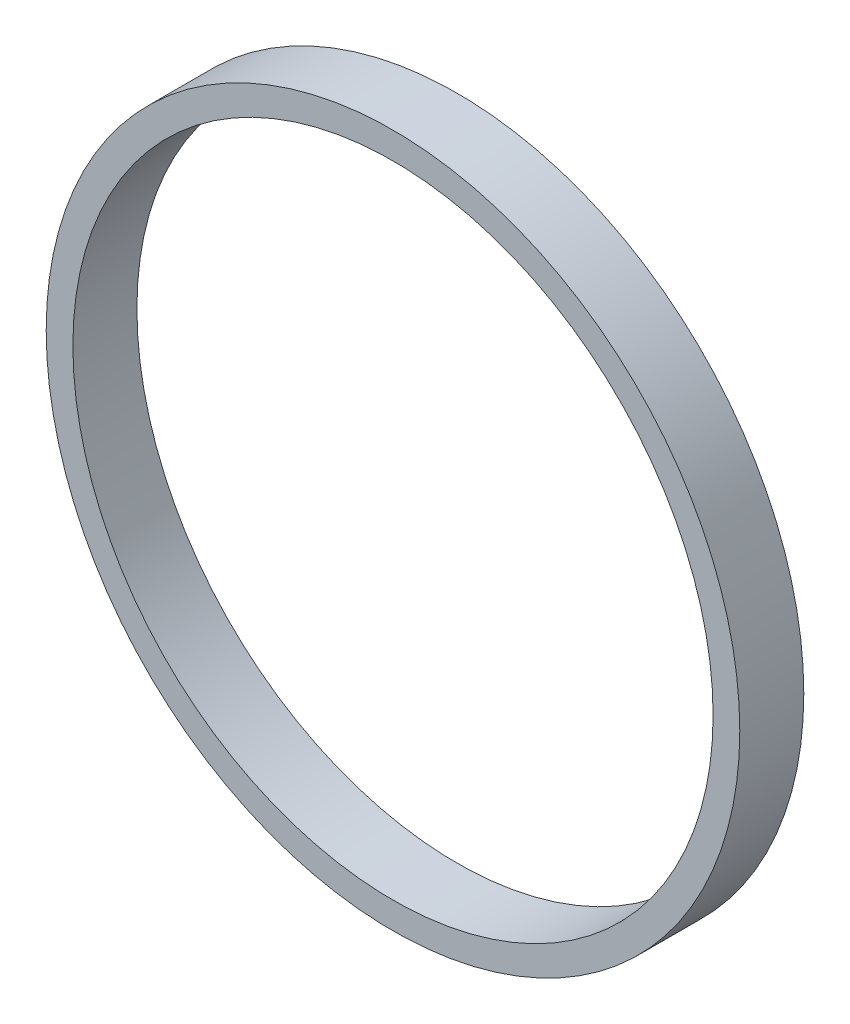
SolidWorks part; units mm, degrees
ref_plane "Front Plane" through (0, 0, 0) normal (0, 0, 1) x (1, 0, 0)
ref_plane "Top Plane" through (0, 0, 0) normal (0, 1, 0) x (1, 0, 0)
ref_plane "Right Plane" through (0, 0, 0) normal (1, 0, 0) x (0, 0, -1)
sketch "Sketch1" plane through (0, 0, 0) normal (0, 0, 1) x (1, 0, 0)
  circle A0 centre (0, 0) radius 32.5
  circle A1 centre (0, 0) radius 30
  dimension "D1" = 65
  dimension "D2" = 60
extrude "Boss-Extrude1" add sketch "Sketch1" along normal mid plane 6
